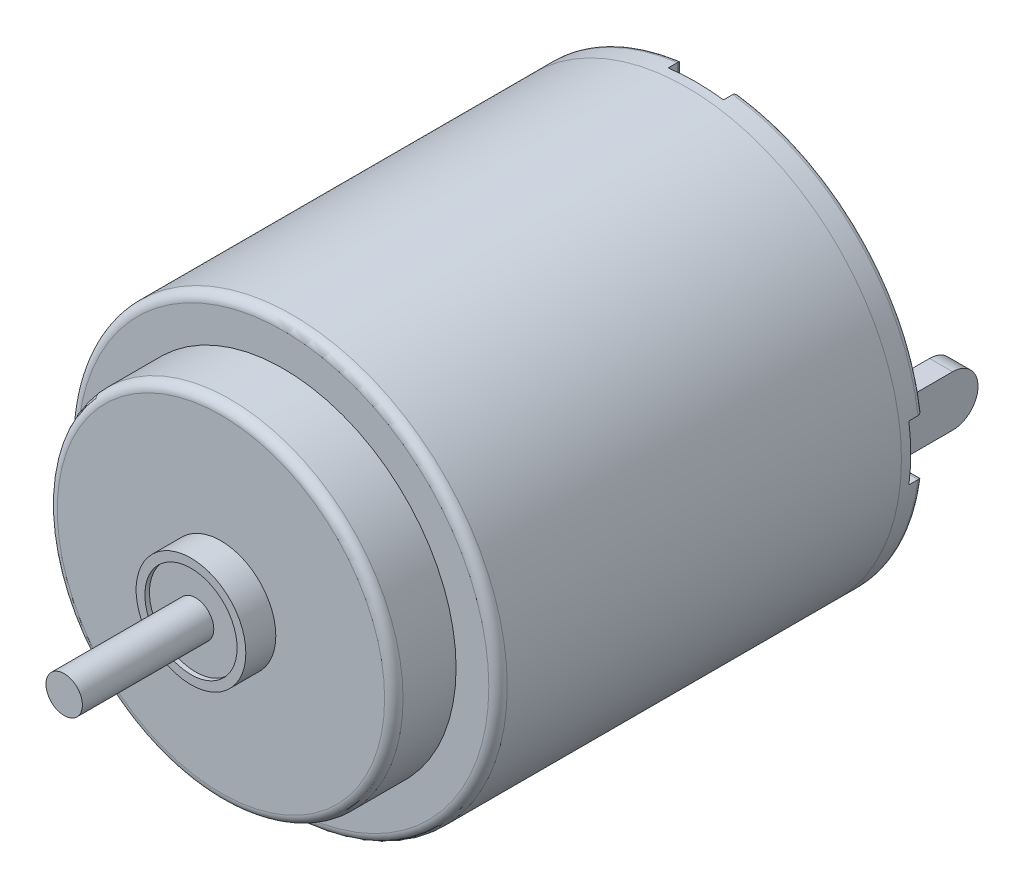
SolidWorks part; units mm, degrees
ref_plane "Front Plane" through (0, 0, 0) normal (0, 0, 1) x (1, 0, 0)
ref_plane "Top Plane" through (0, 0, 0) normal (0, 1, 0) x (1, 0, 0)
ref_plane "Right Plane" through (0, 0, 0) normal (1, 0, 0) x (0, 0, -1)
sketch "Sketch2" plane through (0, 0, 0) normal (0, 0, 1) x (1, 0, 0)
  circle A0 centre (0, 0) radius 11.8364
  dimension "D1" = 23.6728
extrude "Cylinder A" add sketch "Sketch2" along normal blind 23.495
sketch "Sketch3" plane through (0, 0, 23.495) normal (0, 0, 1) x (1, 0, 0)
  circle A0 centre (0, 0) radius 9.525
  dimension "D1" = 19.05
extrude "Cylinder B" add sketch "Sketch3" along normal blind 3.429
sketch "Sketch4" plane through (0, 0, 26.924) normal (0, 0, 1) x (1, 0, 0)
  circle A0 centre (0, 0) radius 3.0226
  dimension "D1" = 6.0452
extrude "Cylinder C" add sketch "Sketch4" along normal blind 1.651
sketch "Sketch5" plane through (0, 0, 28.575) normal (0, 0, 1) x (1, 0, 0)
  circle A0 centre (0, 0) radius 2.54
  dimension "D1" = 5.08
extrude "Depth cut" cut sketch "Sketch5" against normal blind 0.254
sketch "Sketch6" plane through (0, 0, 28.321) normal (0, 0, 1) x (1, 0, 0)
  circle A0 centre (0, 0) radius 1.0033
  dimension "D1" = 2.0066
extrude "Shaft" add sketch "Sketch6" along normal blind 7.239
sketch "Sketch7" plane through (0, 0, 0) normal (0, 0, -1) x (-1, 0, 0)
  line L0 (-2.413, -3.5809) -> (2.413, -3.5809)
  arc A0 (2.413, -3.5809) -> (-2.413, -3.5809) centre (0, 0) ccw
  dimension "D1" = 8.636
  dimension "D2" = 4.826
extrude "Rear cylinder stack" add sketch "Sketch7" along normal blind 1.524
sketch "Sketch8" plane through (0, 0, 0) normal (0, 0, -1) x (-1, 0, 0)
  line L0 (0, 8.7884) -> (0, 0) construction
  line L1 (-1.8288, 7.9196) -> (-1.8288, 5.0107)
  line L2 (-11.8364, 0) -> (-5.334, 0)
  line L3 (0, 8.7884) -> (-6.5098, 8.7884) construction
  line L4 (-1.524, 11.8364) -> (-1.524, 10.3124)
  line L5 (0, 11.8364) -> (-1.524, 11.8364)
  line L6 (0, 11.8364) -> (0, 8.7884)
  line L9 (-11.8364, 1.524) -> (-11.8364, 0)
  line L10 (-11.8364, 1.524) -> (-7.9838, 1.524)
  line L12 (-14.5274, 0) -> (3.2288, 0) construction
  arc A0 (-1.8288, 7.9196) -> (-7.9838, 1.524) centre (0, 0) ccw
  arc A1 (-1.8288, 5.0107) -> (-5.334, 0) centre (0, 0) ccw
  circle A2 centre (0, 0) radius 11.8364 construction
  arc A3 (0, 8.7884) -> (-1.524, 10.3124) centre (0, 10.3124) cw
  dimension "D1" = 5.334
  dimension "D2" = 8.128
  dimension "D3" = 1.524
  dimension "D4" = 3.048
  dimension "D5" = 1.8288
  dimension "D6" = 1.524
extrude "Rear cut-out" cut sketch "Sketch8" against normal blind 0.762
mirror "Mirror A of rear cut-out" about plane through (0, 0, 0) normal (1, 0, 0) of "Rear cut-out"
mirror "Mirror B of rear cut-out" about plane through (0, 0, 0) normal (0, 1, 0) of "Mirror A of rear cut-out", "Rear cut-out"
sketch "Sketch10" plane through (0, 0, 0) normal (0, 0, -1) x (-1, 0, 0)
  circle A0 centre (0, 6.604) radius 0.762
  dimension "D1" = 1.524
  dimension "D2" = 6.604
extrude "Rear hole" cut sketch "Sketch10" against normal up to surface (0.762 mm away)
mirror "Mirror of rear hole" about plane through (0, 0, 0) normal (0, 1, 0) of "Rear cut-out", "Rear hole"
sketch "Sketch11" plane through (0, 0, 0.762) normal (0, 0, -1) x (-1, 0, 0)
  line L1 (-10.4648, 1.397) -> (-9.1948, 1.397)
  line L2 (-10.4648, 1.397) -> (-10.4648, -1.397)
  line L3 (-10.4648, -1.397) -> (-9.1948, -1.397)
  line L4 (-9.1948, 1.397) -> (-9.1948, -1.397)
  line L5 (-10.4648, 1.397) -> (-9.1948, -1.397) construction
  line L6 (-10.4648, -1.397) -> (-9.1948, 1.397) construction
  point P0 (-9.8298, 0)
  dimension "D1" = 2.794
  dimension "D2" = 1.27
  dimension "D3" = 9.1948
extrude "Metal tab" add sketch "Sketch11" along normal blind 5.08
fillet "Fillet of metal tab" radius 1.397 2 edges at (9.8298, -1.397, -4.318) (9.8298, 1.397, -4.318)
mirror "Mirror of metal tab" about plane through (0, 0, 0) normal (1, 0, 0) of "Metal tab", "Fillet of metal tab"
fillet "Rear surface fillet" radius 0.254 28 edges at (5.8564, -5.6362, 0) (1.8288, -6.4651, 0) (5.334, 0, 0) (1.8288, 6.4651, 0) (5.8564, 5.6362, 0) (9.8609, 1.524, 0) (8.3696, 8.3696, 0) (1.524, 11.0251, 0) (0, 8.7884, 0) (-1.524, 11.0251, 0) (-8.3696, 8.3696, 0) (-9.8609, 1.524, 0) (-5.8564, 5.6362, 0) (-1.8288, 6.4651, 0) (-5.334, 0, 0) (-1.8288, -6.4651, 0) (-5.8564, -5.6362, 0) (-9.8609, -1.524, 0) (-8.3696, -8.3696, 0) (-1.524, -11.0251, 0) (0, -8.7884, 0) (1.524, -11.0251, 0) (8.3696, -8.3696, 0) (9.8609, -1.524, 0) (0, -3.5809, 0) (0, 4.318, 0) (-0.762, 6.604, 0) (-0.762, -6.604, 0)
ref_plane "Spliiting plane" through (0, 0, 1.27) normal (0, 0, -1) x (-1, 0, 0)
fillet "Fillet1" radius 0.508 2 edges at (11.8364, 0, 23.495) (9.525, 0, 26.924)
split "Split" trim tools "Spliiting plane" bodies to split 118 resulting bodies 119 120
